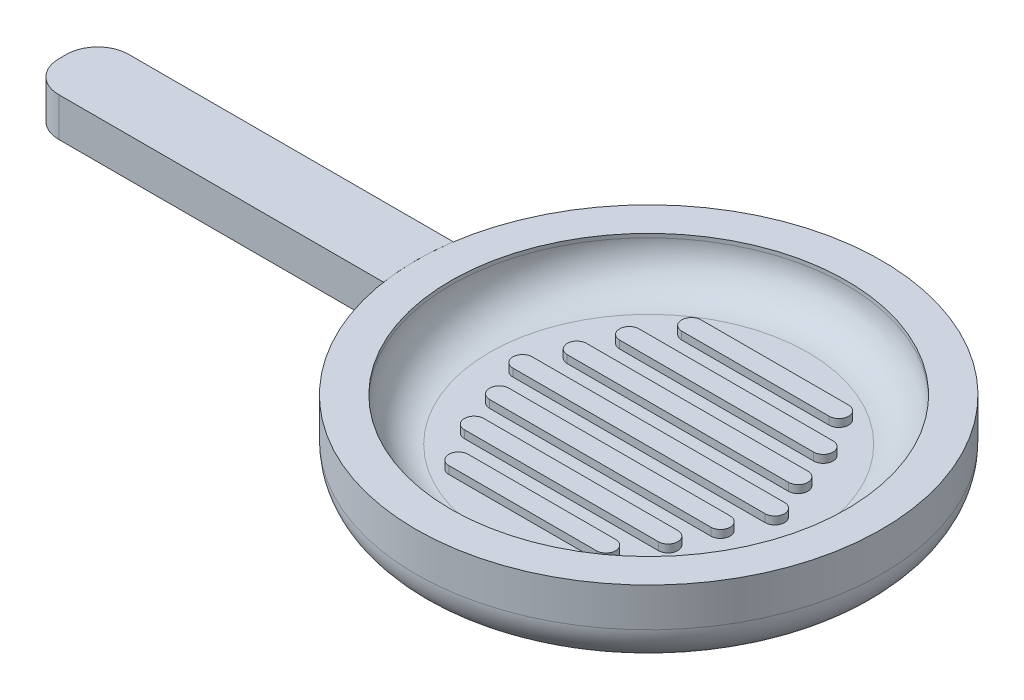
SolidWorks part; units mm, degrees
ref_plane "Front Plane" through (0, 0, 0) normal (0, 0, 1) x (1, 0, 0)
ref_plane "Top Plane" through (0, 0, 0) normal (0, 1, 0) x (1, 0, 0)
ref_plane "Right Plane" through (0, 0, 0) normal (1, 0, 0) x (0, 0, -1)
sketch "Sketch1" plane through (0, 0, 0) normal (0, 1, 0) x (1, 0, 0)
  circle A0 centre (0, 0) radius 60
extrude "Boss-Extrude1" add sketch "Sketch1" along normal blind 20
shell "Shell1" thickness 9
fillet "Fillet1" radius 10 2 edges at (0, 9, 51) (0, 0, 60)
sketch "Sketch3" plane through (0, 9, 0) normal (0, 1, 0) x (1, 0, 0)
  line L0 (0, -10) -> (0, 10) construction
  line L1 (0, -20) -> (0, 20) construction
  line L6 (-25, 20) -> (25, 20) construction
  line L7 (-25, 22.5) -> (25, 22.5)
  line L8 (-25, 17.5) -> (25, 17.5)
  line L9 (-32.5, 0) -> (43.0555, 0) construction
  line L12 (-28.5, 10) -> (28.5, 10) construction
  line L13 (-28.5, 12.5) -> (28.5, 12.5)
  line L14 (-28.5, 7.5) -> (28.5, 7.5)
  line L15 (-28.5, -10) -> (28.5, -10) construction
  line L18 (-32.5, 0) -> (32.5, 0) construction
  line L19 (-32.5, 2.5) -> (32.5, 2.5)
  line L20 (-32.5, -2.5) -> (32.5, -2.5)
  line L21 (-28.5, -12.5) -> (28.5, -12.5)
  line L22 (-28.5, -7.5) -> (28.5, -7.5)
  line L23 (-25, -20) -> (25, -20) construction
  line L24 (-25, -22.5) -> (25, -22.5)
  line L25 (-25, -17.5) -> (25, -17.5)
  line L26 (0, 20) -> (0, 30) construction
  line L27 (-19, 30) -> (19, 30) construction
  line L28 (-19, 32.5) -> (19, 32.5)
  line L29 (-19, 27.5) -> (19, 27.5)
  line L30 (0, -20) -> (0, -30) construction
  line L31 (-19, -30) -> (19, -30) construction
  line L32 (-19, -32.5) -> (19, -32.5)
  line L33 (-19, -27.5) -> (19, -27.5)
  arc A4 (-25, 22.5) -> (-25, 17.5) centre (-25, 20) ccw
  arc A5 (25, 17.5) -> (25, 22.5) centre (25, 20) ccw
  arc A8 (-28.5, 12.5) -> (-28.5, 7.5) centre (-28.5, 10) ccw
  arc A9 (28.5, 7.5) -> (28.5, 12.5) centre (28.5, 10) ccw
  arc A12 (-32.5, 2.5) -> (-32.5, -2.5) centre (-32.5, 0) ccw
  arc A13 (32.5, -2.5) -> (32.5, 2.5) centre (32.5, 0) ccw
  arc A14 (-28.5, -12.5) -> (-28.5, -7.5) centre (-28.5, -10) cw
  arc A15 (28.5, -7.5) -> (28.5, -12.5) centre (28.5, -10) cw
  arc A16 (-25, -22.5) -> (-25, -17.5) centre (-25, -20) cw
  arc A17 (25, -17.5) -> (25, -22.5) centre (25, -20) cw
  arc A18 (-19, 32.5) -> (-19, 27.5) centre (-19, 30) ccw
  arc A19 (19, 27.5) -> (19, 32.5) centre (19, 30) ccw
  arc A20 (-19, -32.5) -> (-19, -27.5) centre (-19, -30) cw
  arc A21 (19, -27.5) -> (19, -32.5) centre (19, -30) cw
  point P7 (0, 0)
  point P9 (0, -10)
  point P16 (0, -20)
  point P19 (0, 20)
  point P33 (0, 10)
  point P38 (0, 30)
  point P47 (0, 0)
  point P53 (0, -30)
extrude "Boss-Extrude4" add sketch "Sketch3" along normal blind 2 contours L28 A19 L29 A18
sketch "Sketch4" plane through (0, 20, 0) normal (0, 1, 0) x (1, 0, 0)
  line L1 (-143, 9) -> (-59.3212, 9)
  line L2 (-151, 1) -> (-151, -1)
  line L3 (-143, -9) -> (-59.3212, -9)
  arc A0 (-143, -9) -> (-151, -1) centre (-143, -1) cw
  arc A1 (-151, 1) -> (-143, 9) centre (-143, 1) cw
  circle A2 centre (0, 0) radius 60 construction
  arc A3 (-59.3212, 9) -> (-59.3212, -9) centre (0, 0) ccw
  dimension "D1" = 8
extrude "Boss-Extrude5" add sketch "Sketch4" against normal blind 10 separate body
